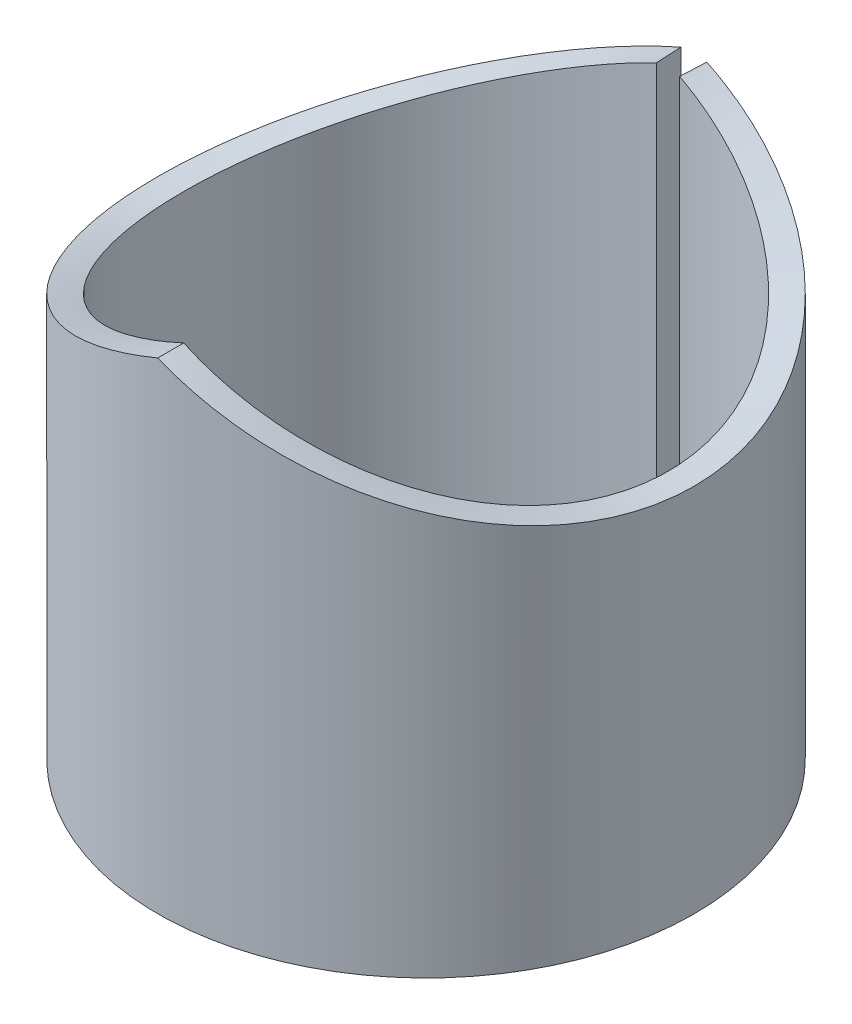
SolidWorks part; units mm, degrees
ref_plane "前视基准面" through (0, 0, 0) normal (0, 0, 1) x (1, 0, 0)
ref_plane "上视基准面" through (0, 0, 0) normal (0, 1, 0) x (1, 0, 0)
ref_plane "右视基准面" through (0, 0, 0) normal (1, 0, 0) x (0, 0, -1)
imported_body "基体零件-带补料的垂直四通管-1"
sheet metal parameters "钣金1" parameters "D1"=0.7366, "厚度"=1
bend "圆角折弯1" bend radius 9.3514 bend angle 354.463 parameters "D5"=1
flatten bends "展开-折弯1" parameters "D1"=0
sketch "尖角-草图1" plane through (-0.5, -27.1237, -10.3393) normal (-0.0483, 0, -0.9988) x (-0.9988, 0, 0.0483)
  line L0 (28.9263, 9.1883) -> (28.9263, -9.1883) construction
process bends "加工-折弯1" parameters "D1"=0
sketch "平面-草图1" plane through (-0.5, -27.1237, -10.3393) normal (-0.0483, 0, -0.9988) x (-0.9988, 0, 0.0483)
